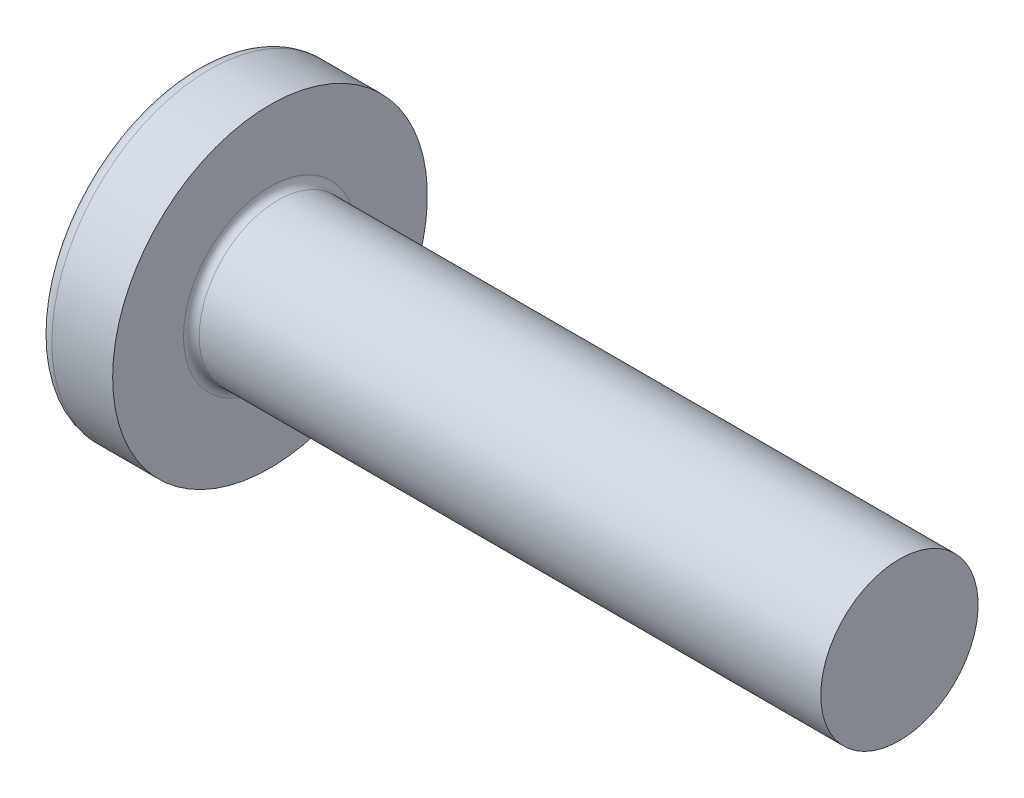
SolidWorks part; units mm, degrees
ref_plane "Plane1" through (0, 0, 0) normal (0, 0, 1) x (1, 0, 0)
ref_plane "Plane2" through (0, 0, 0) normal (0, 1, 0) x (1, 0, 0)
ref_plane "Plane3" through (0, 0, 0) normal (1, 0, 0) x (0, 0, -1)
revolve "Base-Revolve" add sketch "BodySke"
sketch "BodySke" plane through (0, 0, 0) normal (0, 0, 1) x (1, 0, 0)
  line L0 (3.1, 2) -> (3.1, 4)
  line L1 (3.45, 6.35) -> (3.45, -3.175) construction
  line L2 (-25.4, 0) -> (127, 0) construction
  line L3 (19.1, 0) -> (0, 0)
  line L4 (3.1, 2) -> (19.1, 2)
  line L5 (19.1, 2) -> (19.1, 0)
  line L6 (1.5553, 4) -> (3.1, 4)
  line L8 (3.1, 6.35) -> (3.1, -3.175) construction
  arc A0 (1.2654, 3.8534) -> (0, 0) centre (6.5, 0) ccw
  arc A2 (1.2654, 3.8534) -> (1.5553, 4) centre (1.5553, 3.64) cw
  dimension "Head_fillet_rad" = 0.36
  dimension "Head_crown_rad" = 6.5
  dimension "Head_ht" = 3.1
  dimension "Diameter" = 4
  dimension "Length" = 16
  dimension "Head_dia" = 8
  dimension "Advance" = 0.7
  dimension "Thread_nom" = 16
fillet "Fillet1" radius 0.2 1 edges at (3.1, 0, 2)
sketch "Sketch3" plane through (0, 0, 0) normal (1, 0, 0) x (0, 0, -1)
  line L0 (0.515, -2.15) -> (-0.515, -2.15)
  line L1 (0.515, -2.15) -> (0.515, 2.15)
  line L2 (-0.515, 2.15) -> (0.515, 2.15)
  line L3 (-0.515, 2.15) -> (-0.515, -2.15)
  dimension "D1" = 2.15
  dimension "Cross_dia" = 4.3
  dimension "D2" = 0.515
  dimension "Cross_width" = 1.03
ref_plane "Plane4" through (2.34, 0, 0) normal (1, 0, 0) x (0, 0, -1)
sketch "Sketch4" plane through (2.34, 0, 0) normal (1, 0, 0) x (0, 0, -1)
  line L0 (0.515, -0.9833) -> (-0.515, -0.9833)
  line L1 (0.515, -0.9833) -> (0.515, 0.9833)
  line L2 (-0.515, 0.9833) -> (0.515, 0.9833)
  line L3 (-0.515, 0.9833) -> (-0.515, -0.9833)
  dimension "D1" = 1.03
  dimension "D2" = 1.9666
  dimension "D3" = 0.515
  dimension "D4" = 0.9833
loft "Recess" cut profiles "Sketch3", "Sketch4"
pattern_circular "RecPat" count 2 every 90 about axis through (0, 0, 0) along (1, 0, 0) of "Recess"
sketch "RecCorSke" plane through (0, 0, 0) normal (0, 0, 1) x (1, 0, 0)
  line L0 (-3.175, 0) -> (15.875, 0) construction
  line L1 (-25.4, 0) -> (127, 0) construction
  line L2 (0, 0) -> (0, 1.0146)
  line L3 (0, 1.0146) -> (2.34, 0.851)
  line L4 (2.34, 0.851) -> (2.6165, 0)
  line L5 (2.6165, 0) -> (0, 0)
  dimension "Diameter" = 1.702
  dimension "Depth" = 2.34
  dimension "Draft_angle" = 4
  dimension "Bottom_angle" = 18
revolve "RecessCore" cut sketch "RecCorSke" angle 360 about L0
sketch "ThdSchSke" plane through (0, 0, 0) normal (0, 0, 1) x (1, 0, 0)
  line L0 (4.5, -1.61) -> (4.2269, -2)
  line L1 (4.5, -1.61) -> (4.7731, -2)
  line L2 (4.7731, -2) -> (4.7731, -2.5)
  line L3 (-3.175, 0) -> (5.1513, 0) construction
  line L5 (4.7731, -2.5) -> (4.2269, -2.5)
  line L6 (4.2269, -2.5) -> (4.2269, -2)
  dimension "Thread_minor" = 3.22
  dimension "Diameter" = 4
  dimension "Start" = 4.5
  dimension "SideAngle" = 55
  dimension "VeeAngle" = 70
  dimension "Overcut" = 5
revolve "ThreadSchematic" cut sketch "ThdSchSke" angle 360 about L3
pattern_linear "ThdSchPat"
equation "\"D1@Sketch3\" = \"Cross_dia@Sketch3\" / 2"
equation "\"D2@Sketch3\" = \"Cross_width@Sketch3\" / 2"
equation "\"Depth@RecCorSke\" = \"Cross_depth@Plane4\""
equation "\"D1@Sketch4\" = \"Cross_width@Sketch3\""
equation "\"D2@Sketch4\" = \"Cross_dia@Sketch3\" - 2.0 * \"Cross_depth@Plane4\" * tan(26.5  * 0.017453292)"
equation "\"D3@Sketch4\" = \"D1@Sketch4\" / 2"
equation "\"D4@Sketch4\" = \"D2@Sketch4\" / 2"
equation "\"Thread_length@ThreadCosmetic\" = ((sgn( (\"Length@BodySke\" - \"Advance@BodySke\" * 2.0 ) - \"Thread_nom@BodySke\" )-1)*( (\"Length@BodySke\" - \"Advance@BodySke\" * 2.0 ) - \"Thread_nom@BodySke\" ))/-2+ \"Thread_"
equation "\"Thread_minor@ThdSchSke\" = \"Thread_minor@ThreadCosmetic\""
equation "\"Diameter@ThdSchSke\" = \"Diameter@BodySke\""
equation "\"Overcut@ThdSchSke\" = \"Diameter@BodySke\" * 1.25"
equation "\"Start@ThdSchSke\" = \"Head_ht@BodySke\" + \"Length@BodySke\" - \"Thread_length@ThreadCosmetic\"  '---Non-countersunk---"
equation "\"Num_threads@ThdSchPat\" = int( \"Thread_length@ThreadCosmetic\" / \"Advance@BodySke\" + 0.999 )  + 1"
equation "\"Advance@ThdSchPat\" = \"Thread_length@ThreadCosmetic\" /  (\"Num_threads@ThdSchPat\" - 1) 'relax it"
